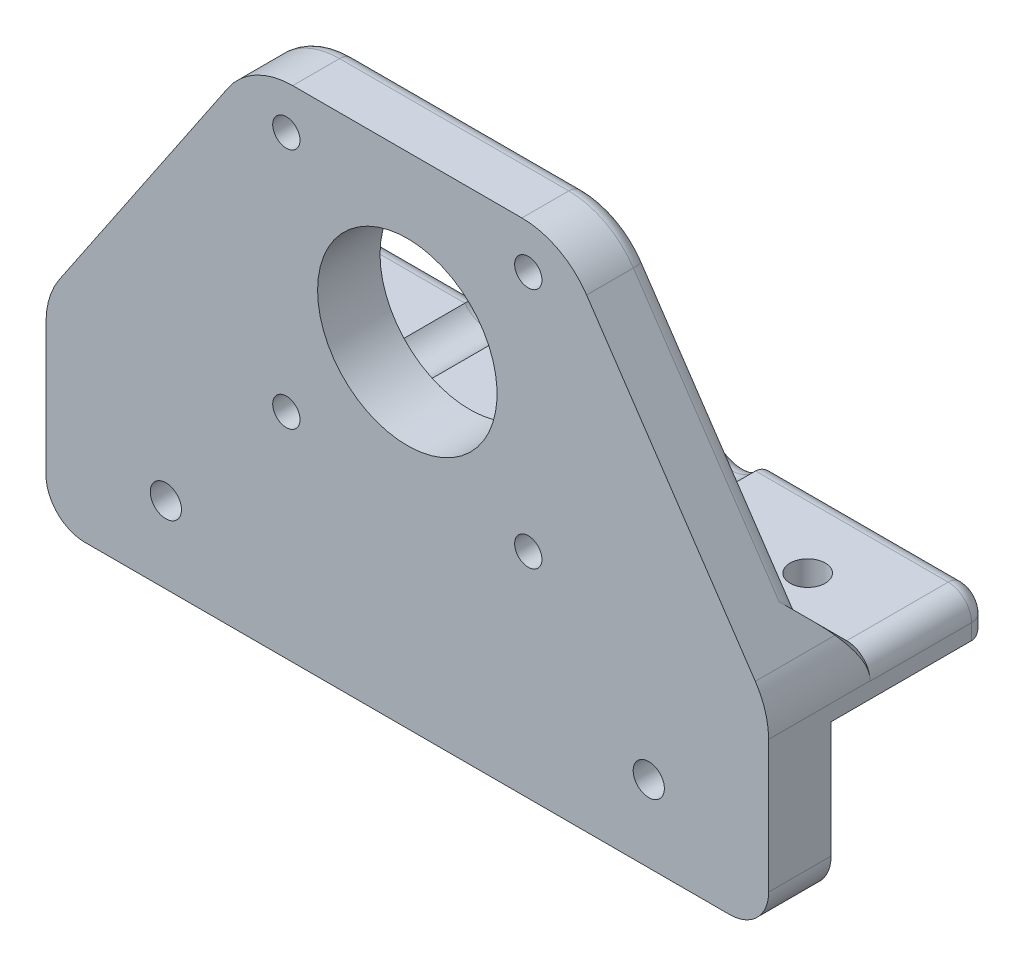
SolidWorks part; units mm, degrees
ref_plane "Alzado" through (0, 0, 0) normal (0, 0, 1) x (1, 0, 0)
ref_plane "Planta" through (0, 0, 0) normal (0, 1, 0) x (1, 0, 0)
ref_plane "Vista lateral" through (0, 0, 0) normal (1, 0, 0) x (0, 0, -1)
sketch "Croquis1" plane through (0, 0, 0) normal (0, 0, 1) x (1, 0, 0)
  line L0 (598, 89.8558) -> (598, 25.8558) construction
  line L1 (612.6821, 89.8558) -> (583.3179, 89.8558)
  line L2 (575.0268, 85.4467) -> (553.4098, 53.3901)
  line L3 (551.7009, 47.7991) -> (551.7009, 30.8558)
  line L4 (556.7009, 25.8558) -> (639.2991, 25.8558)
  line L5 (551.7009, 35.6593) -> (598, 35.6593) construction
  line L6 (644.2991, 47.7991) -> (644.2991, 30.8558)
  line L7 (620.9732, 85.4467) -> (642.5902, 53.3901)
  circle A0 centre (567.0612, 35.6593) radius 2
  arc A1 (551.7009, 30.8558) -> (556.7009, 25.8558) centre (556.7009, 30.8558) ccw
  arc A2 (583.3179, 89.8558) -> (575.0268, 85.4467) centre (583.3179, 79.8558) ccw
  arc A3 (553.4098, 53.3901) -> (551.7009, 47.7991) centre (561.7009, 47.7991) ccw
  arc A4 (642.5902, 53.3901) -> (644.2991, 47.7991) centre (634.2991, 47.7991) cw
  arc A5 (612.6821, 89.8558) -> (620.9732, 85.4467) centre (612.6821, 79.8558) cw
  arc A6 (644.2991, 30.8558) -> (639.2991, 25.8558) centre (639.2991, 30.8558) cw
  circle A7 centre (628.9388, 35.6593) radius 2
  point P11 (551.7009, 25.8558)
  point P14 (578, 89.8558)
  point P17 (551.7009, 50.8558)
  dimension "D4" = 5
  dimension "D5" = 10
  dimension "D1" = 20
  dimension "D2" = 25
  dimension "D3" = 64
extrude "Saliente-Extruir1" add sketch "Croquis1" along normal blind 8
sketch "Croquis2" plane through (0, 0, 0) normal (0, 0, -1) x (-1, 0, 0)
  circle A0 centre (-598, 68.749) radius 11.5
  dimension "D1" = 23
extrude "Cortar-Extruir1" cut sketch "Croquis2" against normal blind 8
sketch "Croquis4" plane through (0, 0, 8) normal (0, 0, 1) x (1, 0, 0)
  circle A0 centre (613.5, 84.249) radius 1.75
  circle A1 centre (582.5, 84.249) radius 1.75
  circle A2 centre (613.5, 53.249) radius 1.75
  circle A3 centre (582.5, 53.249) radius 1.75
extrude "Cortar-Extruir2" cut sketch "Croquis4" against normal blind 8
sketch "Croquis5" plane through (0, 0, 0) normal (0, 0, -1) x (-1, 0, 0)
  line L0 (-644.2991, 30.8558) -> (-644.2991, 47.7991) construction
  line L1 (-644.2991, 45.749) -> (-551.7009, 45.749)
  line L2 (-644.2991, 45.749) -> (-644.2991, 47.749)
  line L3 (-641.2991, 50.749) -> (-616.6225, 50.749)
  line L4 (-551.7009, 45.749) -> (-551.7009, 47.749)
  line L5 (-551.7009, 47.7991) -> (-551.7009, 30.8558) construction
  line L6 (-610.3775, 50.749) -> (-585.6225, 50.749)
  line L7 (-579.3775, 50.749) -> (-554.7009, 50.749)
  arc A0 (-554.7009, 50.749) -> (-551.7009, 47.749) centre (-554.7009, 47.749) cw
  arc A1 (-644.2991, 47.749) -> (-641.2991, 50.749) centre (-641.2991, 47.749) cw
  arc A2 (-616.6225, 50.749) -> (-610.3775, 50.749) centre (-613.5, 53.249) ccw
  arc A3 (-585.6225, 50.749) -> (-579.3775, 50.749) centre (-582.5, 53.249) ccw
  dimension "D2" = 3
  dimension "D3" = 8
  dimension "D4" = 8
  dimension "D1" = 5
extrude "Saliente-Extruir2" add sketch "Croquis5" along normal blind 20
sketch "Croquis6" plane through (0, 0, 0) normal (0, 0, -1) x (-1, 0, 0)
  circle A0 centre (-613.5, 84.249) radius 3.25
  circle A1 centre (-582.5, 84.249) radius 3.25
  circle A2 centre (-613.5, 53.249) radius 3.25
  circle A3 centre (-582.5, 53.249) radius 3.25
  dimension "D1" = 6.5
extrude "Cortar-Extruir3" cut sketch "Croquis6" against normal blind 3
fillet "Redondeo1" radius 2 10 edges at (643.4204, 49.8703, -20) (628.9608, 50.749, -20) (613.5, 49.249, -20) (598, 50.749, -20) (582.5, 49.249, -20) (567.0392, 50.749, -20) (552.5796, 49.8703, -20) (551.7009, 46.749, -20) (598, 45.749, -20) (644.2991, 46.749, -20)
chamfer "Chaflán1" distance 5 angle 45 5 edges at (552.5796, 49.8703, 0) (567.0392, 50.749, 0) (598, 50.749, 0) (628.9608, 50.749, 0) (643.4204, 49.8703, 0)
fillet "Redondeo2" radius 2 5 edges at (565.0137, 70.5979, 0) (578.6226, 88.685, 0) (598, 89.8558, 0) (617.3774, 88.685, 0) (630.9863, 70.5979, 0)
sketch "Croquis7" plane through (0, 50.749, 0) normal (0, 1, 0) x (1, 0, 0)
  line L0 (554.7009, 10) -> (641.2991, 10) construction
  line L1 (554.7009, 18) -> (554.7009, 5) construction
  line L2 (641.2991, 18) -> (641.2991, 5) construction
  line L3 (554.7009, 20) -> (578.5314, 20) construction
  circle A0 centre (564.7009, 10) radius 2.25
  circle A1 centre (598, 10) radius 2.25
  circle A2 centre (631.2991, 10) radius 2.25
  dimension "D2" = 4.5
  dimension "D3" = 4.5
  dimension "D4" = 4.5
  dimension "D1" = 10
  dimension "D5" = 10
  dimension "D6" = 10
extrude "Cortar-Extruir4" cut sketch "Croquis7" against normal blind 5
